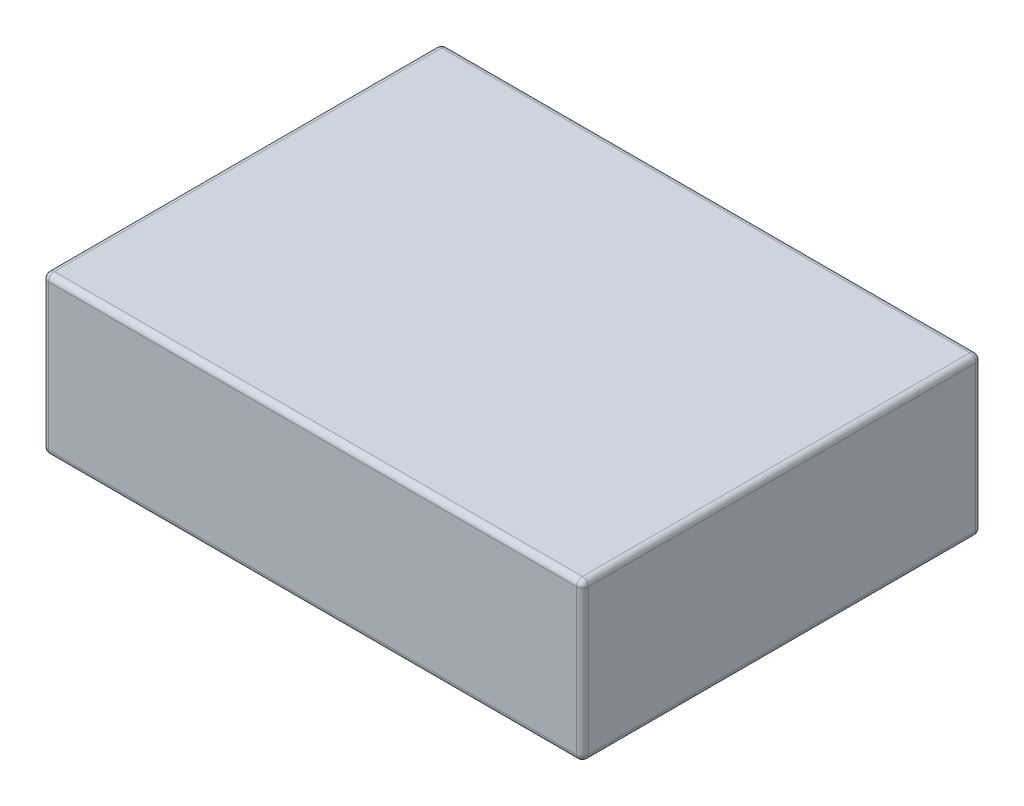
SolidWorks part; units mm, degrees
ref_plane "Front Plane" through (0, 0, 0) normal (0, 0, 1) x (1, 0, 0)
ref_plane "Top Plane" through (0, 0, 0) normal (0, 1, 0) x (1, 0, 0)
ref_plane "Right Plane" through (0, 0, 0) normal (1, 0, 0) x (0, 0, -1)
sketch "Sketch1" plane through (0, 0, 0) normal (0, 1, 0) x (1, 0, 0)
  line L1 (0, 0) -> (23, 0)
  line L2 (0, 0) -> (0, 17)
  line L3 (0, 17) -> (23, 17)
  line L4 (23, 0) -> (23, 17)
  dimension "D1" = 17
  dimension "D2" = 23
extrude "Boss-Extrude1" add sketch "Sketch1" along normal blind 6.7
fillet "Fillet1" radius 0.25 12 edges at (0, 0, -8.5) (0, 3.35, -17) (11.5, 0, -17) (23, 3.35, -17) (23, 0, -8.5) (23, 3.35, 0) (11.5, 0, 0) (0, 3.35, 0) (0, 6.7, -8.5) (11.5, 6.7, -17) (23, 6.7, -8.5) (11.5, 6.7, 0)
